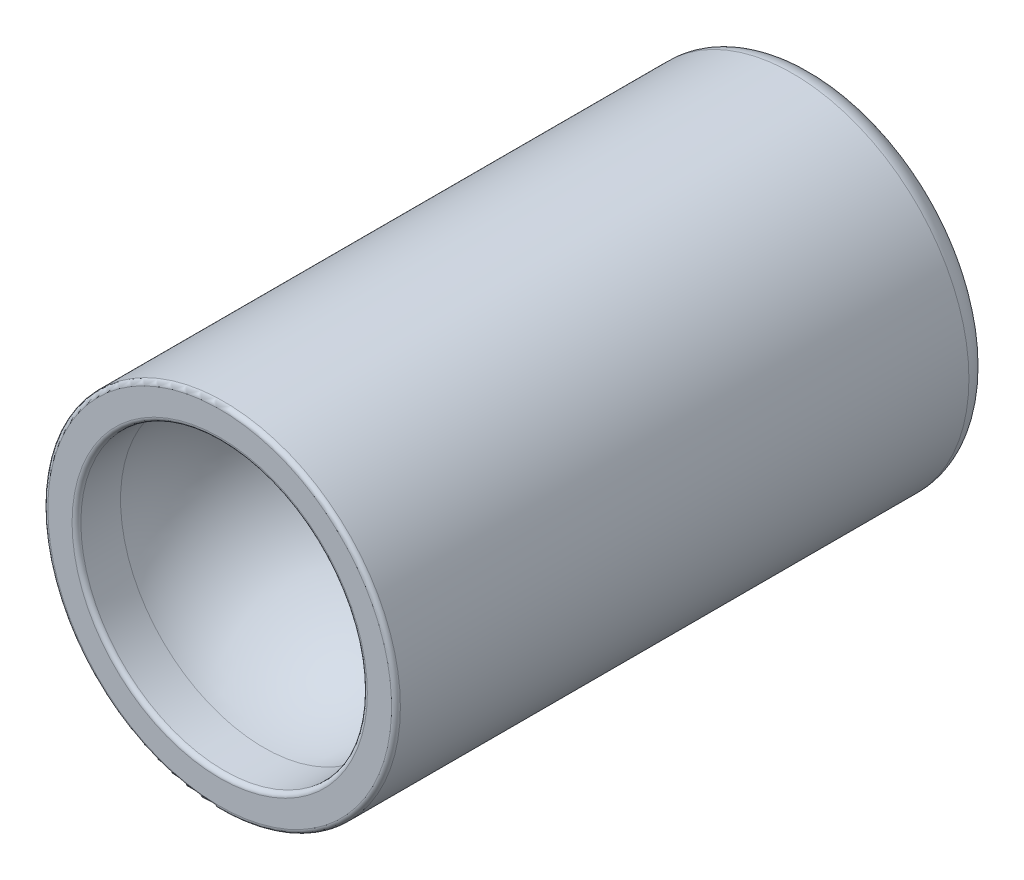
SolidWorks part; units mm, degrees
ref_plane "Plan de face" through (0, 0, 0) normal (0, 0, 1) x (1, 0, 0)
ref_plane "Plan de dessus" through (0, 0, 0) normal (0, 1, 0) x (1, 0, 0)
ref_plane "Plan de droite" through (0, 0, 0) normal (1, 0, 0) x (0, 0, -1)
sketch "Esquisse1" plane through (0, 0, 0) normal (1, 0, 0) x (0, 0, -1)
  line L0 (0, 0) -> (21.5, 0) construction
  line L1 (0, 8) -> (26, 8)
  line L2 (27, 7) -> (27, 6.5)
  line L3 (27, 6.5) -> (21.5, 6.5)
  line L4 (7.6292, 3.25) -> (15.8708, 3.25)
  line L5 (0, 8) -> (0, 6.5)
  line L6 (2, 6.5) -> (0, 6.5)
  arc A0 (7.6292, 3.25) -> (2, 6.5) centre (2, 0) ccw
  arc A1 (21.5, 6.5) -> (15.8708, 3.25) centre (21.5, 0) ccw
  arc A2 (26, 8) -> (27, 7) centre (26, 7) cw
  point P12 (27, 8)
  dimension "D2" = 6.5
  dimension "D6" = 2
  dimension "D7" = 19.5
  dimension "D8" = 6.5
  dimension "D9" = 1
  dimension "D1" = 16
  dimension "D3" = 6.5
  dimension "D4" = 27
  dimension "D5" = 13
revolve "Révolution1" add sketch "Esquisse1" angle 360 about L0
fillet "Congé1" radius 0.2 5 edges at (8, 0, 0) (6.5, 0, -27) (3.25, 0, -15.8708) (3.25, 0, -7.6292) (6.5, 0, 0)
